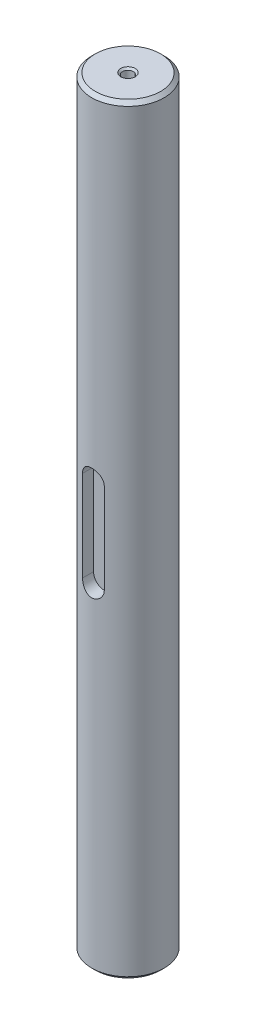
SolidWorks part; units mm, degrees
ref_plane "Front" through (0, 0, 0) normal (0, 0, 1) x (1, 0, 0)
ref_plane "Top" through (0, 0, 0) normal (0, 1, 0) x (1, 0, 0)
ref_plane "Right" through (0, 0, 0) normal (1, 0, 0) x (0, 0, -1)
sketch "Sketch1" plane through (0, 0, 0) normal (0, 1, 0) x (1, 0, 0)
  circle A0 centre (0, 0) radius 10
  dimension "D1" = 20
extrude "Boss-Extrude1" add sketch "Sketch1" along normal mid plane 210
sketch "Sketch2" plane through (1.3502, -105, 1.9232) normal (0, -1, 0) x (1, 0, 0)
  line L0 (-1.3502, 8.0768) -> (-1.3502, -1.9232) construction
  line L1 (-1.3502, -1.9232) -> (-1.3502, 8.0768) construction
  circle A0 centre (-1.3502, -1.9232) radius 10 construction
  circle A2 centre (-1.3502, -1.9232) radius 10
  dimension "Angle from vertical" = 360
ref_plane "Plane1" through (0, -105, 10) normal (0, 0, -1) x (-1, 0, 0)
sketch "Sketch3" plane through (0, -105, 10) normal (0, 0, -1) x (0, -1, 0)
  line L0 (-92.5, 0) -> (-117.5, 0) construction
  line L1 (-92.5, 3) -> (-117.5, 3)
  line L2 (-92.5, -3) -> (-117.5, -3)
  line L3 (-105, 3) -> (-105, -3) construction
  line L4 (-105, 11) -> (-105, -11) construction
  arc A0 (-92.5, 3) -> (-92.5, -3) centre (-92.5, 0) cw
  arc A1 (-117.5, 3) -> (-117.5, -3) centre (-117.5, 0) ccw
  dimension "Keyway width" = 6
  dimension "Length of slot" = 25
extrude "Cut-Extrude1" cut sketch "Sketch3" along normal blind 3.5
other "keyway (bs 4235 - part i)<1>"
chamfer "Chamfer1" distance 1 angle 45 2 edges at (0, 105, 10) (0, -105, 10)
sketch "Sketch4" plane through (0, -105, 0) normal (0, -1, 0) x (1, 0, 0)
  circle A0 centre (0, 0) radius 1.5
  dimension "D1" = 3
extrude "Cut-Extrude2" cut sketch "Sketch4" against normal through all
chamfer "Chamfer2" distance 0.5 angle 45 2 edges at (0, -105, -1.5) (0, 105, -1.5)
